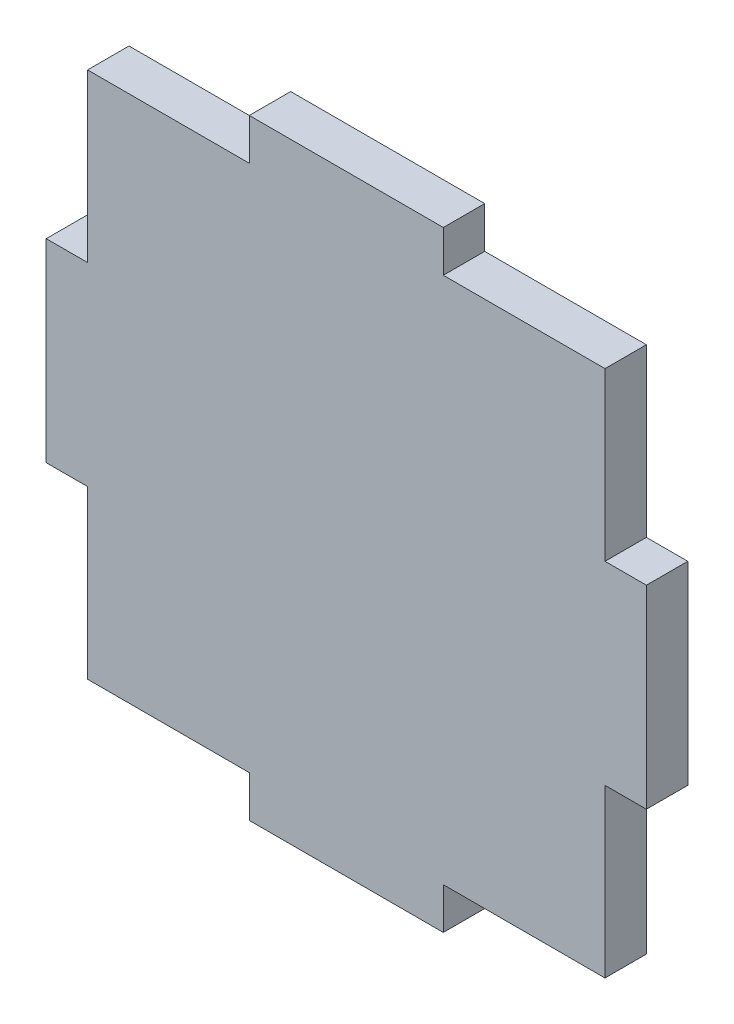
SolidWorks part; units mm, degrees
ref_plane "Front Plane" through (0, 0, 0) normal (0, 0, 1) x (1, 0, 0)
ref_plane "Top Plane" through (0, 0, 0) normal (0, 1, 0) x (1, 0, 0)
ref_plane "Right Plane" through (0, 0, 0) normal (1, 0, 0) x (0, 0, -1)
sketch "Sketch1" plane through (0, 0, 0) normal (0, 0, 1) x (1, 0, 0)
  line L0 (100, 204) -> (100, 0) construction
  line L1 (0, 0) -> (200, 0)
  line L2 (0, 0) -> (0, 204)
  line L3 (0, 204) -> (200, 204)
  line L4 (200, 0) -> (200, 204)
  line L5 (200, 139.5) -> (216, 139.5)
  line L6 (200, 139.5) -> (200, 64.5)
  line L7 (200, 64.5) -> (216, 64.5)
  line L8 (216, 139.5) -> (216, 64.5)
  line L9 (-16, 139.5) -> (-16, 64.5)
  line L10 (0, 64.5) -> (-16, 64.5)
  line L11 (0, 139.5) -> (0, 64.5)
  line L12 (0, 139.5) -> (-16, 139.5)
  line L13 (0, 102) -> (200, 102) construction
  line L14 (62.5, 204) -> (137.5, 204)
  line L15 (62.5, 204) -> (62.5, 220)
  line L16 (62.5, 220) -> (137.5, 220)
  line L17 (137.5, 204) -> (137.5, 220)
  line L18 (137.5, 0) -> (137.5, -16)
  line L19 (62.5, -16) -> (137.5, -16)
  line L20 (62.5, 0) -> (62.5, -16)
  line L21 (62.5, 0) -> (137.5, 0)
  point P10 (200, 102)
  point P11 (216, 102)
  point P22 (100, 220)
extrude "Boss-Extrude1" add sketch "Sketch1" along normal blind 16 contours L2 L12 L9 L10 | L3 L17 L16 L15 | L8 L5 L4 L7 | L1 L20 L19 L18
equation "\"thk\"= 16mm"
equation "\"D3@Sketch1\"=\"thk\""
equation "\"D5@Sketch1\"=\"thk\""
equation "\"D1@Boss-Extrude1\"=\"thk\""
